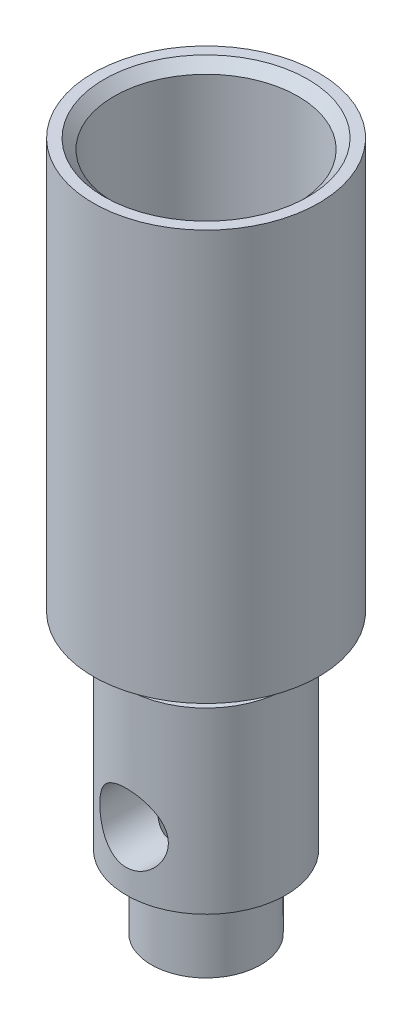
SolidWorks part; units mm, degrees
ref_plane "Plane1" through (0, 0, 0) normal (0, 0, 1) x (1, 0, 0)
ref_plane "Plane2" through (0, 0, 0) normal (0, 1, 0) x (1, 0, 0)
ref_plane "Plane3" through (0, 0, 0) normal (1, 0, 0) x (0, 0, -1)
sketch "Sketch1" plane through (0, 0, 0) normal (0, 0, 1) x (1, 0, 0)
  line L0 (0, 0) -> (0, 75.692) construction
  line L1 (2.3876, 0) -> (3.81, 0)
  line L2 (3.81, 0) -> (3.81, 5.08)
  line L3 (3.81, 5.08) -> (5.5562, 5.08)
  line L4 (5.5562, 5.08) -> (5.5562, 17.526)
  line L5 (5.5562, 17.526) -> (4.6228, 17.526)
  line L6 (4.6228, 17.526) -> (4.6228, 19.431)
  line L7 (4.6228, 19.431) -> (7.8613, 19.431)
  line L8 (7.8613, 19.431) -> (7.8613, 48.006)
  line L9 (2.3876, 25.781) -> (6.4135, 25.781)
  line L10 (6.4135, 25.781) -> (6.4135, 47.3202)
  line L11 (-7.8613, 19.431) -> (-7.8613, 48.006) construction
  line L12 (2.3876, 25.781) -> (2.3876, 0)
  line L13 (-2.3876, 25.781) -> (-2.3876, 0) construction
  line L14 (-4.6228, 19.431) -> (-7.8613, 19.431) construction
  line L15 (-4.6228, 17.526) -> (-4.6228, 19.431) construction
  line L16 (-5.5562, 17.526) -> (-4.6228, 17.526) construction
  line L17 (7.8613, 48.006) -> (7.0993, 48.006)
  line L18 (-7.0993, 48.006) -> (-6.4135, 47.3202) construction
  line L19 (-6.4135, 25.781) -> (-6.4135, 47.3202) construction
  line L20 (-2.3876, 25.781) -> (-6.4135, 25.781) construction
  line L21 (-5.5562, 5.08) -> (-5.5562, 17.526) construction
  line L22 (-3.81, 5.08) -> (-5.5562, 5.08) construction
  line L23 (-3.81, 0) -> (-3.81, 5.08) construction
  line L24 (-2.3876, 0) -> (-3.81, 0) construction
  line L25 (7.0993, 48.006) -> (6.4135, 47.3202)
  line L26 (-7.8613, 48.006) -> (-7.0993, 48.006) construction
  dimension "D1" = 4.7752
  dimension "D2" = 7.62
  dimension "D3" = 5.08
  dimension "D4" = 11.1125
  dimension "D5" = 12.446
  dimension "D6" = 28.575
  dimension "D7" = 22.225
  dimension "D8" = 48.006
  dimension "D9" = 12.827
  dimension "D10" = 15.7226
  dimension "D11" = 9.2456
  dimension "D12" = 0.762
  dimension "D13" = 45
  dimension "D14" = 1.905
revolve "Base-Revolve" add sketch "Sketch1" angle 360 about L0
fillet "Fillet1" radius 0.7874
sketch "Sketch2" plane through (0, 0, 0) normal (0, 0, 1) x (1, 0, 0)
  line L0 (0, 0) -> (0, 75.692) construction
  circle A0 centre (0, 9.144) radius 2.3876
  dimension "D1" = 4.7752
  dimension "D2" = 9.144
extrude "Cut-Extrude1" cut sketch "Sketch2" along normal through all
